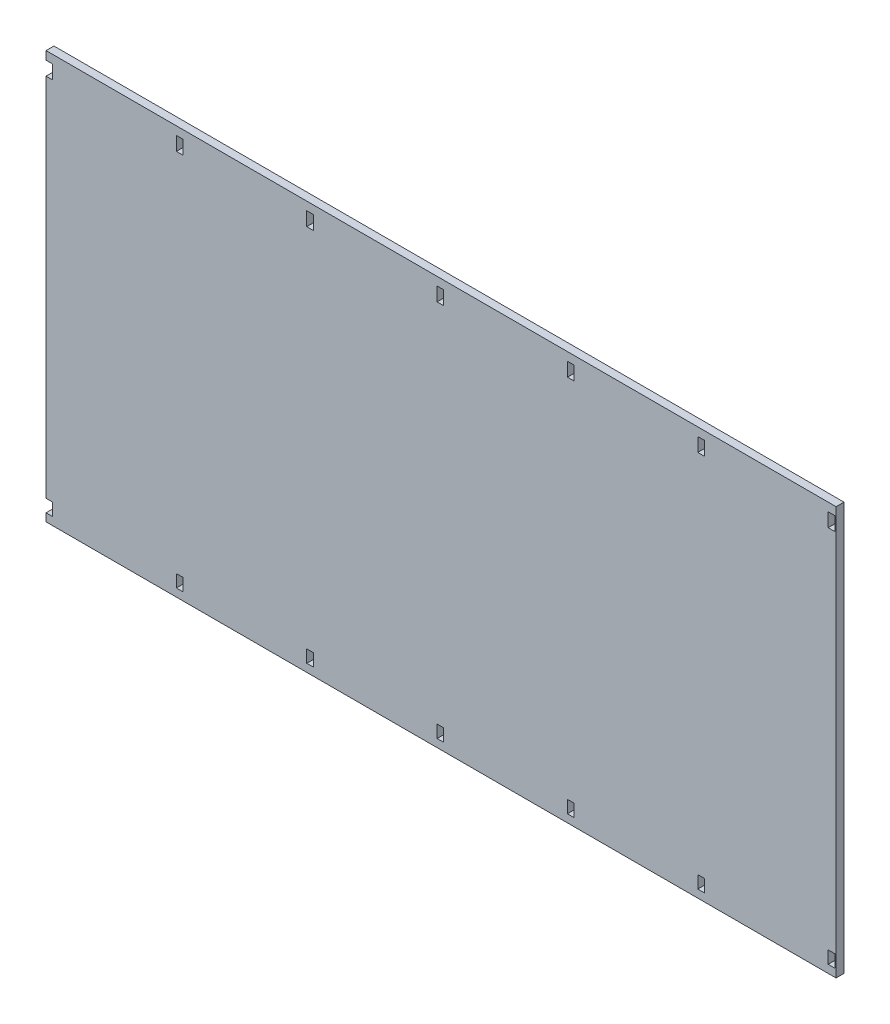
SolidWorks part; units mm, degrees
ref_plane "Alzado" through (0, 0, 0) normal (0, 0, 1) x (1, 0, 0)
ref_plane "Planta" through (0, 0, 0) normal (0, 1, 0) x (1, 0, 0)
ref_plane "Vista lateral" through (0, 0, 0) normal (1, 0, 0) x (0, 0, -1)
sketch "Croquis1" plane through (0, 0, 0) normal (0, 0, 1) x (1, 0, 0)
  line L0 (-100.5, 74.33) -> (-100.5, 69.09)
  line L1 (-150, 77.5) -> (150, 77.5)
  line L2 (-150, 77.5) -> (-150, 74.33)
  line L3 (-150, -77.5) -> (150, -77.5)
  line L4 (150, 77.5) -> (150, -77.5)
  line L5 (-150, 74.33) -> (-147.48, 74.33)
  line L7 (-150, 69.09) -> (-147.48, 69.09)
  line L8 (-147.48, 74.33) -> (-147.48, 69.09)
  line L9 (-100.5, 74.33) -> (-97.98, 74.33)
  line L10 (-100.5, 69.09) -> (-97.98, 69.09)
  line L11 (-97.98, 74.33) -> (-97.98, 69.09)
  line L12 (-51, 74.33) -> (-51, 69.09)
  line L13 (-51, 74.33) -> (-48.48, 74.33)
  line L14 (-51, 69.09) -> (-48.48, 69.09)
  line L15 (-48.48, 74.33) -> (-48.48, 69.09)
  line L16 (-1.5, 74.33) -> (-1.5, 69.09)
  line L17 (-1.5, 74.33) -> (1.02, 74.33)
  line L18 (-1.5, 69.09) -> (1.02, 69.09)
  line L19 (1.02, 74.33) -> (1.02, 69.09)
  line L20 (48, 74.33) -> (48, 69.09)
  line L21 (48, 74.33) -> (50.52, 74.33)
  line L22 (48, 69.09) -> (50.52, 69.09)
  line L23 (50.52, 74.33) -> (50.52, 69.09)
  line L24 (97.5, 74.33) -> (97.5, 69.09)
  line L25 (97.5, 74.33) -> (100.02, 74.33)
  line L26 (97.5, 69.09) -> (100.02, 69.09)
  line L27 (100.02, 74.33) -> (100.02, 69.09)
  line L28 (147, 74.33) -> (147, 69.09)
  line L29 (147, 74.33) -> (149.52, 74.33)
  line L30 (147, 69.09) -> (149.52, 69.09)
  line L31 (149.52, 74.33) -> (149.52, 69.09)
  line L32 (-100.5, -69.74) -> (-100.5, -74.5)
  line L33 (-150, -69.74) -> (-147.48, -69.74)
  line L35 (-150, -74.5) -> (-147.48, -74.5)
  line L36 (-147.48, -69.74) -> (-147.48, -74.5)
  line L37 (-100.5, -74.5) -> (-97.98, -74.5)
  line L38 (-97.98, -69.74) -> (-97.98, -74.5)
  line L39 (-100.5, -69.74) -> (-97.98, -69.74)
  line L40 (-51, -69.74) -> (-51, -74.5)
  line L41 (-51, -74.5) -> (-48.48, -74.5)
  line L42 (-48.48, -69.74) -> (-48.48, -74.5)
  line L43 (-51, -69.74) -> (-48.48, -69.74)
  line L44 (-1.5, -69.74) -> (-1.5, -74.5)
  line L45 (-1.5, -74.5) -> (1.02, -74.5)
  line L46 (1.02, -69.74) -> (1.02, -74.5)
  line L47 (-1.5, -69.74) -> (1.02, -69.74)
  line L48 (48, -69.74) -> (48, -74.5)
  line L49 (48, -74.5) -> (50.52, -74.5)
  line L50 (50.52, -69.74) -> (50.52, -74.5)
  line L51 (48, -69.74) -> (50.52, -69.74)
  line L52 (97.5, -69.74) -> (97.5, -74.5)
  line L53 (97.5, -74.5) -> (100.02, -74.5)
  line L54 (100.02, -69.74) -> (100.02, -74.5)
  line L55 (97.5, -69.74) -> (100.02, -69.74)
  line L56 (147, -69.74) -> (147, -74.5)
  line L57 (147, -74.5) -> (149.52, -74.5)
  line L58 (149.52, -69.74) -> (149.52, -74.5)
  line L59 (147, -69.74) -> (149.52, -69.74)
  line L60 (-150, 69.09) -> (-150, -69.74)
  line L61 (-150, -74.5) -> (-150, -77.5)
extrude "Saliente-Extruir1" add sketch "Croquis1" along normal blind 3
sketch "Croquis2" plane through (0, 0, 3) normal (0, 0, 1) x (1, 0, 0)
  line L0 (-150, 64.09) -> (-1, 64.09)
  line L5 (-150, 69.09) -> (-150, -69.74) construction
  line L6 (-147.48, 69.09) -> (-150, 69.09) construction
  line L7 (-150, 60.09) -> (-1, 60.09)
  line L8 (-148, 62.09) -> (148, 62.09)
  line L9 (150, -77.5) -> (150, 77.5) construction
  line L10 (150, 64.09) -> (1, 64.09)
  line L11 (1, 60.09) -> (150, 60.09)
  line L14 (-150, 60.09) -> (-1, 60.09)
  line L15 (-148, 58.09) -> (148, 58.09)
  line L16 (-150, 56.09) -> (-1, 56.09)
  line L17 (1, 56.09) -> (150, 56.09)
  line L18 (150, 60.09) -> (1, 60.09)
  line L19 (-150, 56.09) -> (-1, 56.09)
  line L20 (-148, 54.09) -> (148, 54.09)
  line L21 (-150, 52.09) -> (-1, 52.09)
  line L22 (1, 52.09) -> (150, 52.09)
  line L23 (150, 56.09) -> (1, 56.09)
  line L24 (-150, 52.09) -> (-1, 52.09)
  line L25 (-148, 50.09) -> (148, 50.09)
  line L26 (-150, 48.09) -> (-1, 48.09)
  line L27 (1, 48.09) -> (150, 48.09)
  line L28 (150, 52.09) -> (1, 52.09)
  line L29 (-150, 48.09) -> (-1, 48.09)
  line L30 (-148, 46.09) -> (148, 46.09)
  line L31 (-150, 44.09) -> (-1, 44.09)
  line L32 (1, 44.09) -> (150, 44.09)
  line L33 (150, 48.09) -> (1, 48.09)
  line L34 (-150, 44.09) -> (-1, 44.09)
  line L35 (-148, 42.09) -> (148, 42.09)
  line L36 (-150, 40.09) -> (-1, 40.09)
  line L37 (1, 40.09) -> (150, 40.09)
  line L38 (150, 44.09) -> (1, 44.09)
  line L39 (-150, 40.09) -> (-1, 40.09)
  line L40 (-148, 38.09) -> (148, 38.09)
  line L41 (-150, 36.09) -> (-1, 36.09)
  line L42 (1, 36.09) -> (150, 36.09)
  line L43 (150, 40.09) -> (1, 40.09)
  line L44 (-150, 36.09) -> (-1, 36.09)
  line L45 (-148, 34.09) -> (148, 34.09)
  line L46 (-150, 32.09) -> (-1, 32.09)
  line L47 (1, 32.09) -> (150, 32.09)
  line L48 (150, 36.09) -> (1, 36.09)
  line L49 (-150, 32.09) -> (-1, 32.09)
  line L50 (-148, 30.09) -> (148, 30.09)
  line L51 (-150, 28.09) -> (-1, 28.09)
  line L52 (1, 28.09) -> (150, 28.09)
  line L53 (150, 32.09) -> (1, 32.09)
  line L54 (-150, 28.09) -> (-1, 28.09)
  line L55 (-148, 26.09) -> (148, 26.09)
  line L56 (-150, 24.09) -> (-1, 24.09)
  line L57 (1, 24.09) -> (150, 24.09)
  line L58 (150, 28.09) -> (1, 28.09)
  line L59 (-150, 24.09) -> (-1, 24.09)
  line L60 (-148, 22.09) -> (148, 22.09)
  line L61 (-150, 20.09) -> (-1, 20.09)
  line L62 (1, 20.09) -> (150, 20.09)
  line L63 (150, 24.09) -> (1, 24.09)
  line L64 (-150, 20.09) -> (-1, 20.09)
  line L65 (-148, 18.09) -> (148, 18.09)
  line L66 (-150, 16.09) -> (-1, 16.09)
  line L67 (1, 16.09) -> (150, 16.09)
  line L68 (150, 20.09) -> (1, 20.09)
  line L69 (-150, 16.09) -> (-1, 16.09)
  line L70 (-148, 14.09) -> (148, 14.09)
  line L71 (-150, 12.09) -> (-1, 12.09)
  line L72 (1, 12.09) -> (150, 12.09)
  line L73 (150, 16.09) -> (1, 16.09)
  line L74 (-150, 12.09) -> (-1, 12.09)
  line L75 (-148, 10.09) -> (148, 10.09)
  line L76 (-150, 8.09) -> (-1, 8.09)
  line L77 (1, 8.09) -> (150, 8.09)
  line L78 (150, 12.09) -> (1, 12.09)
  line L79 (-150, 8.09) -> (-1, 8.09)
  line L80 (-148, 6.09) -> (148, 6.09)
  line L81 (-150, 4.09) -> (-1, 4.09)
  line L82 (1, 4.09) -> (150, 4.09)
  line L83 (150, 8.09) -> (1, 8.09)
  line L84 (-150, 4.09) -> (-1, 4.09)
  line L85 (-148, 2.09) -> (148, 2.09)
  line L86 (-150, 0.09) -> (-1, 0.09)
  line L87 (1, 0.09) -> (150, 0.09)
  line L88 (150, 4.09) -> (1, 4.09)
  line L89 (-150, 0.09) -> (-1, 0.09)
  line L90 (-148, -1.91) -> (148, -1.91)
  line L91 (-150, -3.91) -> (-1, -3.91)
  line L92 (1, -3.91) -> (150, -3.91)
  line L93 (150, 0.09) -> (1, 0.09)
  line L94 (-150, -3.91) -> (-1, -3.91)
  line L95 (-148, -5.91) -> (148, -5.91)
  line L96 (-150, -7.91) -> (-1, -7.91)
  line L97 (1, -7.91) -> (150, -7.91)
  line L98 (150, -3.91) -> (1, -3.91)
  line L99 (-150, -7.91) -> (-1, -7.91)
  line L100 (-148, -9.91) -> (148, -9.91)
  line L101 (-150, -11.91) -> (-1, -11.91)
  line L102 (1, -11.91) -> (150, -11.91)
  line L103 (150, -7.91) -> (1, -7.91)
  line L104 (-150, -11.91) -> (-1, -11.91)
  line L105 (-148, -13.91) -> (148, -13.91)
  line L106 (-150, -15.91) -> (-1, -15.91)
  line L107 (1, -15.91) -> (150, -15.91)
  line L108 (150, -11.91) -> (1, -11.91)
  line L109 (-150, -15.91) -> (-1, -15.91)
  line L110 (-148, -17.91) -> (148, -17.91)
  line L111 (-150, -19.91) -> (-1, -19.91)
  line L112 (1, -19.91) -> (150, -19.91)
  line L113 (150, -15.91) -> (1, -15.91)
  line L114 (-150, -19.91) -> (-1, -19.91)
  line L115 (-148, -21.91) -> (148, -21.91)
  line L116 (-150, -23.91) -> (-1, -23.91)
  line L117 (1, -23.91) -> (150, -23.91)
  line L118 (150, -19.91) -> (1, -19.91)
  line L119 (-150, -23.91) -> (-1, -23.91)
  line L120 (-148, -25.91) -> (148, -25.91)
  line L121 (-150, -27.91) -> (-1, -27.91)
  line L122 (1, -27.91) -> (150, -27.91)
  line L123 (150, -23.91) -> (1, -23.91)
  line L124 (-150, -27.91) -> (-1, -27.91)
  line L125 (-148, -29.91) -> (148, -29.91)
  line L126 (-150, -31.91) -> (-1, -31.91)
  line L127 (1, -31.91) -> (150, -31.91)
  line L128 (150, -27.91) -> (1, -27.91)
  line L129 (-150, -31.91) -> (-1, -31.91)
  line L130 (-148, -33.91) -> (148, -33.91)
  line L131 (-150, -35.91) -> (-1, -35.91)
  line L132 (1, -35.91) -> (150, -35.91)
  line L133 (150, -31.91) -> (1, -31.91)
  line L134 (-150, -35.91) -> (-1, -35.91)
  line L135 (-148, -37.91) -> (148, -37.91)
  line L136 (-150, -39.91) -> (-1, -39.91)
  line L137 (1, -39.91) -> (150, -39.91)
  line L138 (150, -35.91) -> (1, -35.91)
  line L139 (-150, -39.91) -> (-1, -39.91)
  line L140 (-148, -41.91) -> (148, -41.91)
  line L141 (-150, -43.91) -> (-1, -43.91)
  line L142 (1, -43.91) -> (150, -43.91)
  line L143 (150, -39.91) -> (1, -39.91)
  line L144 (-150, -43.91) -> (-1, -43.91)
  line L145 (-148, -45.91) -> (148, -45.91)
  line L146 (-150, -47.91) -> (-1, -47.91)
  line L147 (1, -47.91) -> (150, -47.91)
  line L148 (150, -43.91) -> (1, -43.91)
  line L149 (-150, -47.91) -> (-1, -47.91)
  line L150 (-148, -49.91) -> (148, -49.91)
  line L151 (-150, -51.91) -> (-1, -51.91)
  line L152 (1, -51.91) -> (150, -51.91)
  line L153 (150, -47.91) -> (1, -47.91)
  line L154 (-150, -51.91) -> (-1, -51.91)
  line L155 (-148, -53.91) -> (148, -53.91)
  line L156 (-150, -55.91) -> (-1, -55.91)
  line L157 (1, -55.91) -> (150, -55.91)
  line L158 (150, -51.91) -> (1, -51.91)
  line L159 (-150, -55.91) -> (-1, -55.91)
  line L160 (-148, -57.91) -> (148, -57.91)
  line L161 (-150, -59.91) -> (-1, -59.91)
  line L162 (1, -59.91) -> (150, -59.91)
  line L163 (150, -55.91) -> (1, -55.91)
  line L164 (-150, -59.91) -> (-1, -59.91)
  line L165 (-148, -61.91) -> (148, -61.91)
  line L166 (-150, -63.91) -> (-1, -63.91)
  line L167 (1, -63.91) -> (150, -63.91)
  line L168 (150, -59.91) -> (1, -59.91)
  line L171 (-100.5, 74.33) -> (-100.5, 69.09)
  line L172 (-100.5, 69.09) -> (-97.98, 69.09)
  line L173 (-97.98, 69.09) -> (-97.98, 74.33)
  line L174 (-97.98, 74.33) -> (-100.5, 74.33)
  line L175 (-100.5, 74.33) -> (-100.5, 69.09)
  line L176 (-100.5, 69.09) -> (-97.98, 69.09)
  line L177 (-97.98, 69.09) -> (-97.98, 74.33)
  line L178 (-97.98, 74.33) -> (-100.5, 74.33)
  line L179 (97.5, 74.33) -> (97.5, 69.09)
  line L180 (97.5, 69.09) -> (100.02, 69.09)
  line L181 (100.02, 69.09) -> (100.02, 74.33)
  line L182 (100.02, 74.33) -> (97.5, 74.33)
  line L183 (97.5, 74.33) -> (97.5, 69.09)
  line L184 (97.5, 69.09) -> (100.02, 69.09)
  line L185 (100.02, 69.09) -> (100.02, 74.33)
  line L186 (100.02, 74.33) -> (97.5, 74.33)
  line L187 (48, 74.33) -> (48, 69.09)
  line L188 (48, 69.09) -> (50.52, 69.09)
  line L189 (50.52, 69.09) -> (50.52, 74.33)
  line L190 (50.52, 74.33) -> (48, 74.33)
  line L191 (48, 74.33) -> (48, 69.09)
  line L192 (48, 69.09) -> (50.52, 69.09)
  line L193 (50.52, 69.09) -> (50.52, 74.33)
  line L194 (50.52, 74.33) -> (48, 74.33)
  line L195 (-1.5, 74.33) -> (-1.5, 69.09)
  line L196 (-1.5, 69.09) -> (1.02, 69.09)
  line L197 (1.02, 69.09) -> (1.02, 74.33)
  line L198 (1.02, 74.33) -> (-1.5, 74.33)
  line L199 (-1.5, 74.33) -> (-1.5, 69.09)
  line L200 (-1.5, 69.09) -> (1.02, 69.09)
  line L201 (1.02, 69.09) -> (1.02, 74.33)
  line L202 (1.02, 74.33) -> (-1.5, 74.33)
  line L203 (-51, 74.33) -> (-51, 69.09)
  line L204 (-48.48, 74.33) -> (-51, 74.33)
  line L205 (-48.48, 69.09) -> (-48.48, 74.33)
  line L206 (-51, 69.09) -> (-48.48, 69.09)
  line L207 (-51, 74.33) -> (-51, 69.09)
  line L208 (-48.48, 74.33) -> (-51, 74.33)
  line L209 (-48.48, 69.09) -> (-48.48, 74.33)
  line L210 (-51, 69.09) -> (-48.48, 69.09)
  line L211 (-51, -69.74) -> (-51, -74.5)
  line L212 (-51, -74.5) -> (-48.48, -74.5)
  line L213 (-48.48, -74.5) -> (-48.48, -69.74)
  line L214 (-48.48, -69.74) -> (-51, -69.74)
  line L215 (-51, -69.74) -> (-51, -74.5)
  line L216 (-51, -74.5) -> (-48.48, -74.5)
  line L217 (-48.48, -74.5) -> (-48.48, -69.74)
  line L218 (-48.48, -69.74) -> (-51, -69.74)
  line L219 (-100.5, -69.74) -> (-100.5, -74.5)
  line L220 (-100.5, -74.5) -> (-97.98, -74.5)
  line L221 (-97.98, -74.5) -> (-97.98, -69.74)
  line L222 (-97.98, -69.74) -> (-100.5, -69.74)
  line L223 (-100.5, -69.74) -> (-100.5, -74.5)
  line L224 (-100.5, -74.5) -> (-97.98, -74.5)
  line L225 (-97.98, -74.5) -> (-97.98, -69.74)
  line L226 (-97.98, -69.74) -> (-100.5, -69.74)
  line L227 (-147.48, -69.74) -> (-147.48, -74.5)
  line L228 (-147.48, -74.5) -> (-150, -74.5)
  line L229 (-150, -74.5) -> (-150, -77.5)
  line L230 (-150, -77.5) -> (150, -77.5)
  line L231 (150, -77.5) -> (150, 77.5)
  line L232 (150, 77.5) -> (-150, 77.5)
  line L233 (-150, 77.5) -> (-150, 74.33)
  line L234 (-150, 74.33) -> (-147.48, 74.33)
  line L235 (-147.48, 74.33) -> (-147.48, 69.09)
  line L236 (-147.48, 69.09) -> (-150, 69.09)
  line L237 (-150, 69.09) -> (-150, -69.74)
  line L238 (-150, -69.74) -> (-147.48, -69.74)
  line L239 (-147.48, -69.74) -> (-147.48, -74.5)
  line L240 (-147.48, -74.5) -> (-150, -74.5)
  line L241 (-150, -74.5) -> (-150, -77.5)
  line L242 (-150, -77.5) -> (150, -77.5)
  line L243 (150, -77.5) -> (150, 77.5)
  line L244 (150, 77.5) -> (-150, 77.5)
  line L245 (-150, 77.5) -> (-150, 74.33)
  line L246 (-150, 74.33) -> (-147.48, 74.33)
  line L247 (-147.48, 74.33) -> (-147.48, 69.09)
  line L248 (-147.48, 69.09) -> (-150, 69.09)
  line L249 (-150, 69.09) -> (-150, -69.74)
  line L250 (-150, -69.74) -> (-147.48, -69.74)
  line L251 (147, 74.33) -> (147, 69.09)
  line L252 (149.52, 74.33) -> (147, 74.33)
  line L253 (149.52, 69.09) -> (149.52, 74.33)
  line L254 (147, 69.09) -> (149.52, 69.09)
  line L255 (147, 74.33) -> (147, 69.09)
  line L256 (149.52, 74.33) -> (147, 74.33)
  line L257 (149.52, 69.09) -> (149.52, 74.33)
  line L258 (147, 69.09) -> (149.52, 69.09)
  line L259 (147, -69.74) -> (147, -74.5)
  line L260 (147, -74.5) -> (149.52, -74.5)
  line L261 (149.52, -74.5) -> (149.52, -69.74)
  line L262 (149.52, -69.74) -> (147, -69.74)
  line L263 (147, -69.74) -> (147, -74.5)
  line L264 (147, -74.5) -> (149.52, -74.5)
  line L265 (149.52, -74.5) -> (149.52, -69.74)
  line L266 (149.52, -69.74) -> (147, -69.74)
  line L267 (97.5, -69.74) -> (97.5, -74.5)
  line L268 (97.5, -74.5) -> (100.02, -74.5)
  line L269 (100.02, -74.5) -> (100.02, -69.74)
  line L270 (100.02, -69.74) -> (97.5, -69.74)
  line L271 (97.5, -69.74) -> (97.5, -74.5)
  line L272 (97.5, -74.5) -> (100.02, -74.5)
  line L273 (100.02, -74.5) -> (100.02, -69.74)
  line L274 (100.02, -69.74) -> (97.5, -69.74)
  line L275 (48, -69.74) -> (48, -74.5)
  line L276 (48, -74.5) -> (50.52, -74.5)
  line L277 (50.52, -74.5) -> (50.52, -69.74)
  line L278 (50.52, -69.74) -> (48, -69.74)
  line L279 (48, -69.74) -> (48, -74.5)
  line L280 (48, -74.5) -> (50.52, -74.5)
  line L281 (50.52, -74.5) -> (50.52, -69.74)
  line L282 (50.52, -69.74) -> (48, -69.74)
  line L283 (-1.5, -74.5) -> (1.02, -74.5)
  line L284 (1.02, -74.5) -> (1.02, -69.74)
  line L285 (1.02, -69.74) -> (-1.5, -69.74)
  line L286 (-1.5, -69.74) -> (-1.5, -74.5)
  line L287 (-1.5, -74.5) -> (1.02, -74.5)
  line L288 (1.02, -74.5) -> (1.02, -69.74)
  line L289 (1.02, -69.74) -> (-1.5, -69.74)
  line L290 (-1.5, -69.74) -> (-1.5, -74.5)
equation "\"leng\"=155"
equation "\"D3@Croquis1\"=\"leng\""
equation "\"D4@Croquis1\"=\"leng\"/2"
equation "\"val\"=300"
equation "\"D1@Croquis1\"=\"val\""
equation "\"D2@Croquis1\"=\"val\"/2"
equation "\"kerf\"= .24"
equation "\"mat\"= 3mm"
equation "\"D7@Croquis1\"=\"mat\"-(2*\"kerf\")"
equation "\"2var\"=4"
equation "\"D2@Croquis2\"=\"2var\""
equation "\"D3@Croquis2\"=\"2var\"/2"
